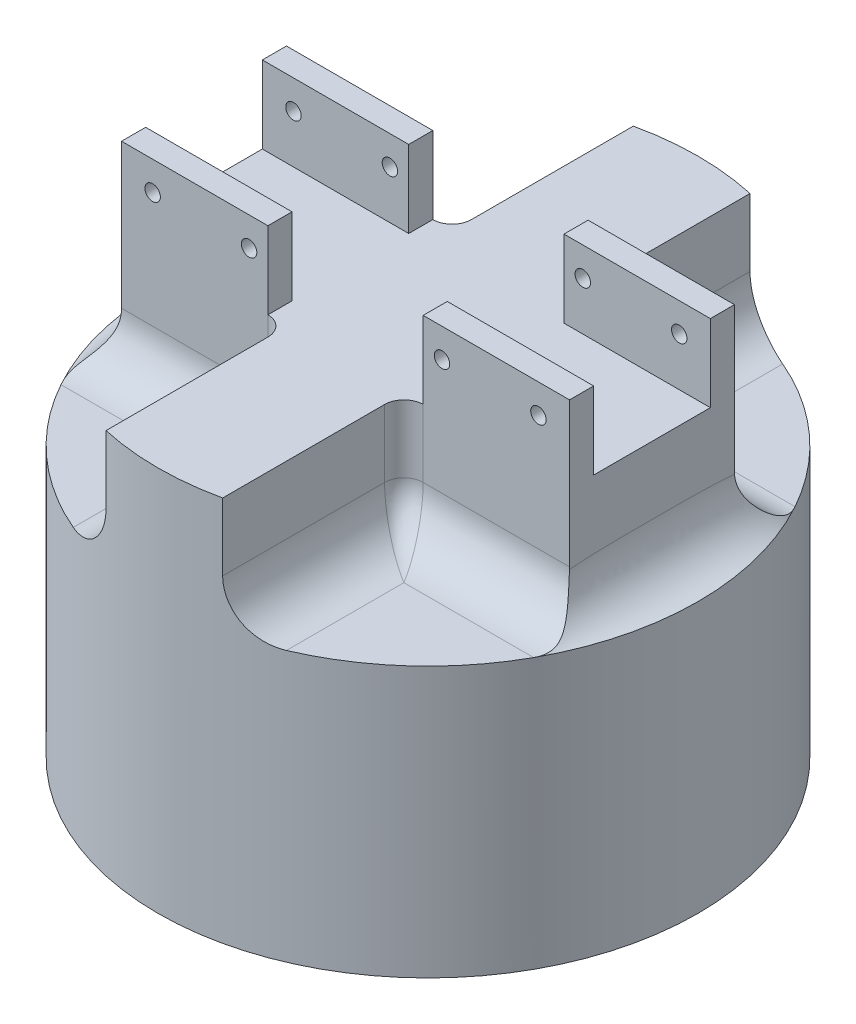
SolidWorks part; units mm, degrees
ref_plane "Front Plane" through (0, 0, 0) normal (0, 0, 1) x (1, 0, 0)
ref_plane "Top Plane" through (0, 0, 0) normal (0, 1, 0) x (1, 0, 0)
ref_plane "Right Plane" through (0, 0, 0) normal (1, 0, 0) x (0, 0, -1)
sketch "Sketch1" plane through (0, 0, 0) normal (0, 0, 1) x (1, 0, 0)
  line L1 (-23.2249, -4) -> (-8.05, -4)
  line L2 (-23.2249, -4) -> (-23.2249, -24)
  line L4 (-8.05, -4) -> (-8.05, -12)
  line L5 (8.05, -4) -> (23.2249, -4)
  line L6 (8.05, -4) -> (8.05, -12)
  line L8 (23.2249, -4) -> (23.2249, -24)
  line L9 (-8.05, -12) -> (8.05, -12)
  line L13 (-23.2249, -24) -> (23.2249, -24)
  circle A0 centre (-20, -7) radius 0.8 construction
  circle A1 centre (-20, -7) radius 0.8
  circle A2 centre (-10, -7) radius 0.8 construction
  circle A3 centre (-10, -7) radius 0.8
  circle A4 centre (10, -7) radius 0.8 construction
  circle A5 centre (10, -7) radius 0.8
  circle A6 centre (20, -7) radius 0.8 construction
  circle A7 centre (20, -7) radius 0.8
  dimension "D1" = 46.4499
  dimension "D4" = 20
  dimension "D5" = 20
extrude "Boss-Extrude1" add sketch "Sketch1" along normal blind 2.5
ref_plane "Plane2" through (0, 0, -6.05) normal (0, 0, 1) x (1, 0, 0)
mirror "Mirror1" about plane through (0, 0, -6.05) normal (0, 0, 1)
sketch "Sketch2" plane through (0, 0, 0) normal (0, 0, -1) x (-1, 0, 0)
  line L0 (23.2249, -4) -> (23.2249, -24) construction
  line L1 (-23.2249, -24) -> (23.2249, -24)
  line L2 (-23.2249, -24) -> (-23.2249, -12)
  line L3 (-23.2249, -12) -> (23.2249, -12)
  line L4 (23.2249, -24) -> (23.2249, -12)
extrude "Boss-Extrude2" add sketch "Sketch2" along normal up to next
sketch "Sketch3" plane through (0, -24, 0) normal (0, -1, 0) x (1, 0, 0)
  line L0 (-23.2249, -6.05) -> (23.2249, -6.05) construction
  line L1 (-23.2249, 2.5) -> (-23.2249, -14.6) construction
  line L2 (23.2249, 2.5) -> (23.2249, -14.6) construction
  line L3 (0, -14.6) -> (0, 2.5) construction
  line L4 (-23.2249, -14.6) -> (23.2249, -14.6) construction
  line L5 (-23.2249, 2.5) -> (23.2249, 2.5) construction
  circle A0 centre (0, -6.05) radius 28
  dimension "D1" = 56
extrude "Boss-Extrude3" add sketch "Sketch3" along normal up to surface (28 mm away)
sketch "Sketch5" plane through (0, -24, 0) normal (0, 1, 0) x (1, 0, 0)
  line L0 (-23.2249, -2.5) -> (23.2249, -2.5) construction
  line L1 (-6.05, -2.5) -> (6.05, -2.5)
  line L2 (-6.05, -2.5) -> (-6.05, -21.2886)
  line L4 (6.05, -2.5) -> (6.05, -21.2886)
  line L5 (-26.4, 6.05) -> (26.4, 6.05) construction
  line L6 (-6.05, 14.6) -> (-6.05, 33.3886)
  line L7 (-6.05, 14.6) -> (6.05, 14.6)
  line L8 (6.05, 14.6) -> (6.05, 33.3886)
  arc A0 (-6.05, 33.3886) -> (6.05, 33.3886) centre (0, 6.05) cw
  circle A1 centre (0, 6.05) radius 28
  arc A2 (-6.05, -21.2886) -> (6.05, -21.2886) centre (0, 6.05) ccw
  point P1 (0, -2.5)
  point P2 (0, -2.5)
  dimension "D2" = 12.1
  dimension "D1" = 0
ref_plane "Plane3" through (0, -12, 0) normal (0, 1, 0) x (1, 0, 0)
extrude "Boss-Extrude5" add sketch "Sketch5" along normal up to surface (12 mm away)
fillet "Fillet2" radius 2 4 edges at (6.05, -18, 2.5) (-6.05, -18, 2.5) (-6.05, -18, -14.6) (6.05, -18, -14.6)
fillet "Fillet3" radius 5 12 edges at (15.6375, -24, -14.6) (6.6358, -24, -15.1858) (-6.05, -24, -24.9943) (-6.6358, -24, -15.1858) (-15.6375, -24, 2.5) (-6.6358, -24, 3.0858) (15.6375, -24, 2.5) (6.6358, -24, 3.0858) (6.05, -24, -24.9943) (-15.6375, -24, -14.6) (-6.05, -24, 12.8943) (6.05, -24, 12.8943)
fillet "Fillet4" radius 5 2 edges at (-23.2249, -24, -6.05) (23.2249, -24, -6.05)
